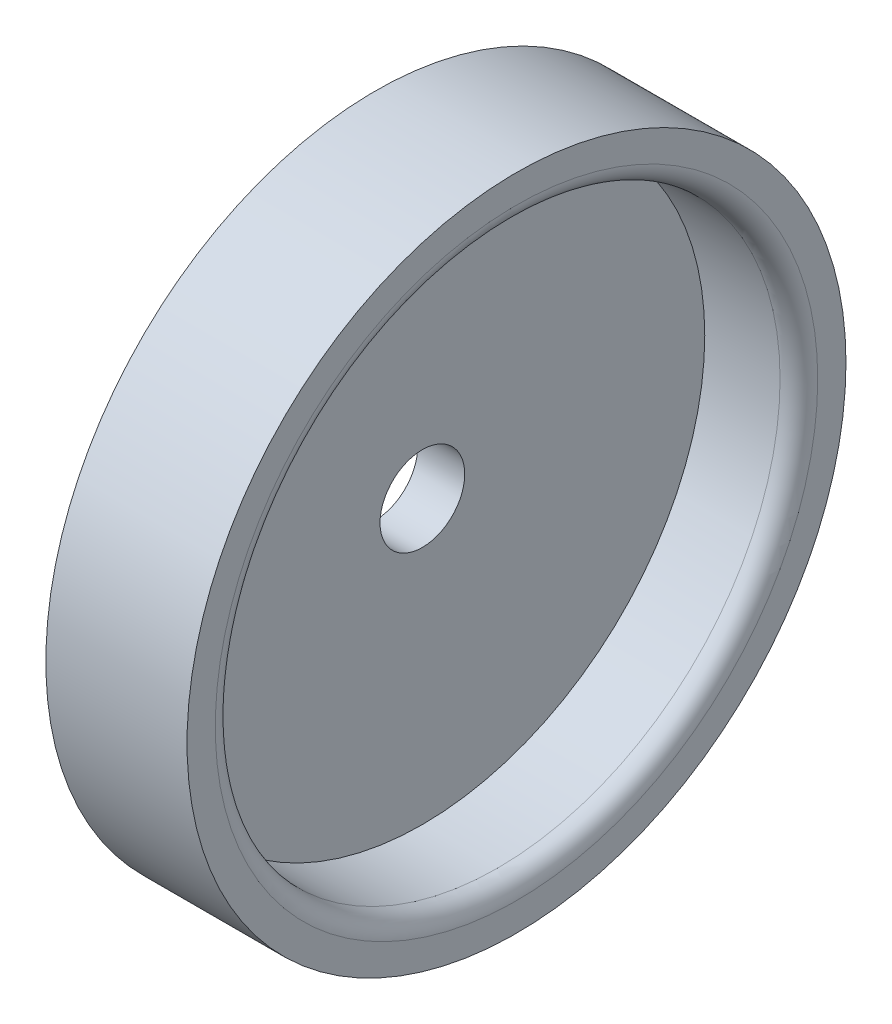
SolidWorks part; units mm, degrees
ref_plane "Ebene vorne" through (0, 0, 0) normal (0, 0, 1) x (1, 0, 0)
ref_plane "Ebene oben" through (0, 0, 0) normal (0, 1, 0) x (1, 0, 0)
ref_plane "Ebene rechts" through (0, 0, 0) normal (1, 0, 0) x (0, 0, -1)
sketch "Skizze1" plane through (0, 0, 0) normal (0, 0, 1) x (1, 0, 0)
  line L0 (0, 0) -> (-9770.0422, 0) construction
  line L1 (0, 0) -> (0, 30)
  line L2 (0, 30) -> (10, 30)
  line L3 (10, 30) -> (10, 35)
  line L4 (10, 35) -> (-5, 35)
  line L5 (-5, 35) -> (-5, 0)
  line L6 (-5, 0) -> (0, 0)
  line L7 (-5, 20) -> (0, 20) construction
  line L8 (-5, 20) -> (-5, 35) construction
  line L9 (0, 20) -> (0, 30) construction
  dimension "D1" = 5
  dimension "D2" = 60
  dimension "D3" = 5
  dimension "D4" = 10
  dimension "D5" = 20
revolve "Rotation1" add sketch "Skizze1" angle 360 about L0
fillet "Verrundung1" radius 2 1 edges at (10, 0, -30)
hole_wizard "M10x1.0 Gewindebohrung1" positions "Skizze3" profile "Skizze2" tap size "M10x1.0" standard "DIN"
sketch "Skizze3" plane through (-5, 0, 0) normal (-1, 0, 0) x (0, 0, 1)
  point P0 (0, 0)
sketch "Skizze2" plane through (-5, 0, 0) normal (0, 1, 0) x (0, 0, 1)
  line L0 (0, 0) -> (0, 15)
  line L1 (0, 15) -> (4.5, 15)
  line L2 (4.5, 15) -> (4.5, 0)
  line L5 (4.5, 0) -> (0, 0)
  line L11 (0, -6.35) -> (0, 107.95) construction
  dimension "Bohrerdurchmesser" = 9
  dimension "Bohrungstiefe" = 15
